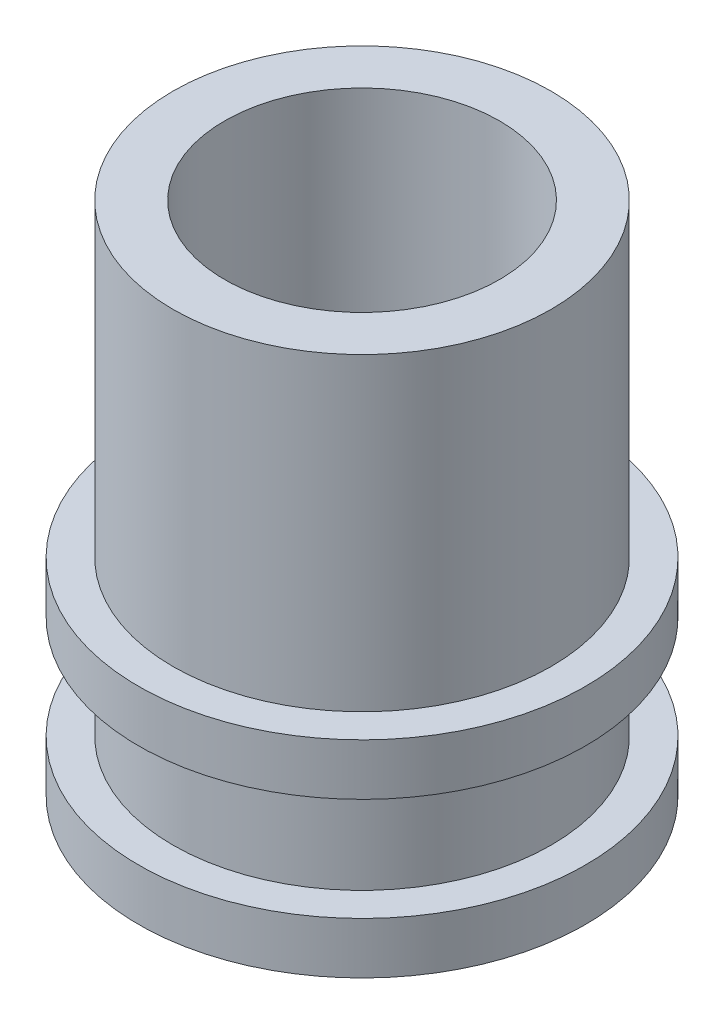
SolidWorks part; units mm, degrees
ref_plane "Plan1" through (0, 0, 0) normal (0, 0, 1) x (1, 0, 0)
ref_plane "Plan2" through (0, 0, 0) normal (0, 1, 0) x (1, 0, 0)
ref_plane "Plan3" through (0, 0, 0) normal (1, 0, 0) x (0, 0, -1)
sketch "Esquisse1" plane through (0, 0, 0) normal (0, 0, 1) x (1, 0, 0)
  line L0 (0, 0) -> (0, 20) construction
  line L1 (-4, 15) -> (-4, 0)
  line L2 (-5.5, 15) -> (-5.5, 6)
  line L3 (-4, 0) -> (-6.5, 0)
  line L4 (-6.5, 0) -> (-6.5, 1.5)
  line L5 (-6.5, 1.5) -> (-5.5, 1.5)
  line L7 (-5.5, 4.5) -> (-6.5, 4.5)
  line L8 (-6.5, 4.5) -> (-6.5, 6)
  line L9 (-6.5, 6) -> (-5.5, 6)
  line L10 (-5.5, 15) -> (-4, 15)
  line L11 (-5.5, 4.5) -> (-5.5, 1.5)
  dimension "D1" = 8
  dimension "D2" = 11
  dimension "D3" = 15
  dimension "D4" = 1.5
  dimension "D5" = 1.5
  dimension "D6" = 3
  dimension "D7" = 13
revolve "Base-Révolution" add sketch "Esquisse1" angle 360 about L0
